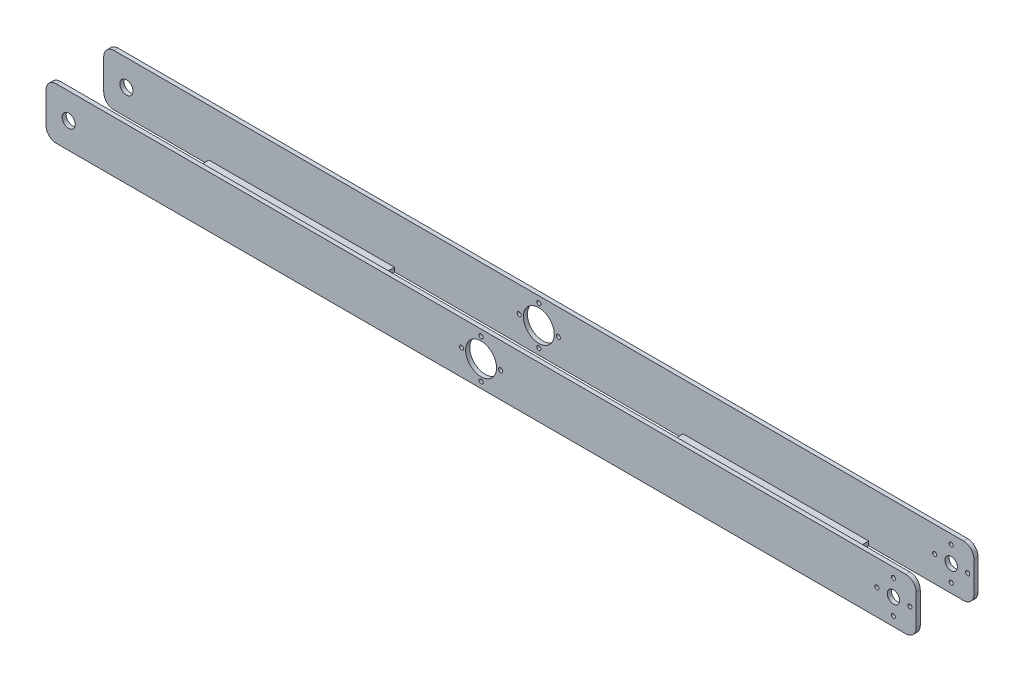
SolidWorks part; units mm, degrees
ref_plane "Front Plane" through (0, 0, 0) normal (0, 0, 1) x (1, 0, 0)
ref_plane "Top Plane" through (0, 0, 0) normal (0, 1, 0) x (1, 0, 0)
ref_plane "Right Plane" through (0, 0, 0) normal (1, 0, 0) x (0, 0, -1)
sketch "Sketch1" plane through (0, 0, 0) normal (0, 0, 1) x (1, 0, 0)
  line L1 (-211, -12.5) -> (211, -12.5)
  line L2 (-211, -12.5) -> (-211, 12.5)
  line L3 (-211, 12.5) -> (211, 12.5)
  line L5 (-211, -12.5) -> (211, 12.5) construction
  line L6 (-211, 12.5) -> (211, -12.5) construction
  line L9 (211, 12.5) -> (211, -12.5)
  point P0 (0, 0)
  dimension "D1" = 422
extrude "Boss-Extrude1" add sketch "Sketch1" along normal blind 30
shell "Shell1" thickness 2
sketch "Sketch2" plane through (0, 12.5, 0) normal (0, 1, 0) x (1, 0, 0)
  line L0 (-211, -30) -> (-211, -28) construction
  line L1 (-211, -2) -> (-160, -2)
  line L2 (-211, -2) -> (-211, -28)
  line L3 (-211, -28) -> (-160, -28)
  line L4 (-160, -2) -> (-160, -28)
  line L5 (211, -2) -> (160, -2)
  line L6 (-70, -2) -> (70, -2)
  line L7 (-70, -2) -> (-70, -28)
  line L8 (-70, -28) -> (70, -28)
  line L9 (70, -2) -> (70, -28)
  line L14 (211, 0) -> (-211, 0) construction
  line L15 (211, -30) -> (-211, -30) construction
  line L16 (211, -2) -> (211, -28)
  line L24 (160, -2) -> (160, -28)
  line L25 (211, -28) -> (160, -28)
  line L27 (211, -30) -> (211, -28) construction
  line L29 (211, -30) -> (-211, -30) construction
  dimension "D1" = 141
  dimension "D2" = 2
  dimension "D3" = 2
  dimension "D4" = 2
  dimension "D5" = 51
  dimension "D6" = 141
  dimension "D8" = 2
  dimension "D9" = 2
  dimension "D10" = 51
extrude "Cut-Extrude1" cut sketch "Sketch2" against normal through all
sketch "Sketch4" plane through (0, 0, 30) normal (0, 0, 1) x (1, 0, 0)
  line L0 (0, 12.5) -> (0, 0) construction
  line L1 (211, 12.5) -> (-211, 12.5) construction
  line L2 (0, 0) -> (0, -12.5) construction
  line L3 (-211, -12.5) -> (211, -12.5) construction
  line L4 (0, 0) -> (-211, 0) construction
  line L5 (-211, 12.5) -> (-211, -12.5) construction
  circle A0 centre (0, 0) radius 7.5
  circle A5 centre (-200, 0) radius 3.2
  circle A6 centre (0, 9.5) radius 1
  circle A7 centre (9.5, 0) radius 1
  circle A8 centre (0, -9.5) radius 1
  circle A9 centre (-9.5, 0) radius 1
  dimension "D2" = 9.5
  dimension "D3" = 15
  dimension "D4" = 9.5
  dimension "D5" = 9.5
  dimension "D6" = 9.5
  dimension "D12" = 6.4
  dimension "D7" = 2
  dimension "D8" = 2
  dimension "D9" = 2
  dimension "D10" = 2
  dimension "D11" = 200
extrude "Cut-Extrude3" cut sketch "Sketch4" against normal through all
sketch "Sketch5" plane through (0, 0, 0) normal (0, 0, -1) x (-1, 0, 0)
  line L0 (-211, 0) -> (211, 0) construction
  line L1 (-200, 12.5) -> (-200, -12.5) construction
  line L2 (-211, 12.5) -> (211, 12.5) construction
  line L3 (211, -12.5) -> (-211, -12.5) construction
  line L4 (-211, -12.5) -> (-211, 12.5) construction
  line L6 (211, 12.5) -> (211, -12.5) construction
  circle A0 centre (-200, 0) radius 3
  circle A1 centre (-200, 8) radius 1
  circle A2 centre (-192, 0) radius 1
  circle A3 centre (-208, 0) radius 1
  circle A4 centre (-200, -8) radius 1
  dimension "D2" = 6
  dimension "D3" = 8
  dimension "D4" = 8
  dimension "D5" = 8
  dimension "D6" = 8
  dimension "D7" = 2
  dimension "D8" = 2
  dimension "D9" = 2
  dimension "D10" = 2
  dimension "D1" = 200
extrude "Cut-Extrude4" cut sketch "Sketch5" against normal through all and the other way through all
fillet "Fillet2" radius 5 8 edges at (-211, -12.5, 1) (-211, 12.5, 1) (-211, -12.5, 29) (-211, 12.5, 29) (211, -12.5, 1) (211, -12.5, 29) (211, 12.5, 29) (211, 12.5, 1)
